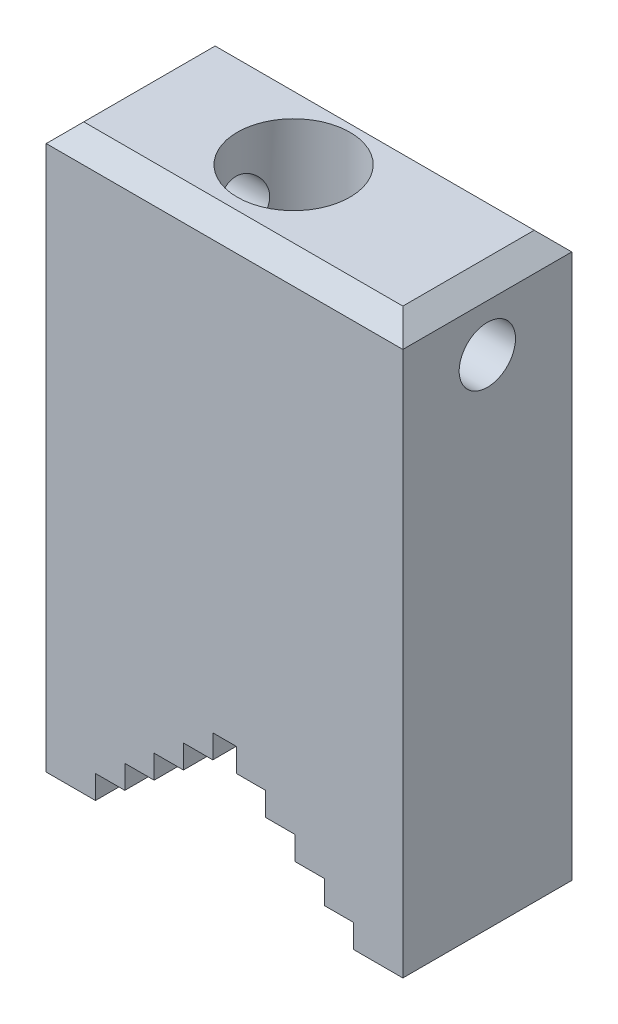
SolidWorks part; units mm, degrees
ref_plane "Front Plane" through (0, 0, 0) normal (0, 0, 1) x (1, 0, 0)
ref_plane "Top Plane" through (0, 0, 0) normal (0, 1, 0) x (1, 0, 0)
ref_plane "Right Plane" through (0, 0, 0) normal (1, 0, 0) x (0, 0, -1)
sketch "Sketch1" plane through (0, 0, 0) normal (0, 0, 1) x (1, 0, 0)
  line L0 (0, 0) -> (0, 23.3729) construction
  line L1 (-19, 0) -> (-13.75, 0)
  line L2 (-19, 0) -> (-19, 60)
  line L3 (-19, 60) -> (19, 60)
  line L4 (19, 0) -> (19, 60)
  line L5 (19, 0) -> (13.75, 0)
  line L6 (-13.75, 0) -> (-13.75, 2.5)
  line L7 (13.75, 0) -> (13.75, 2.5)
  line L8 (-13.75, 2.5) -> (-10.625, 2.5)
  line L9 (13.75, 2.5) -> (10.625, 2.5)
  line L10 (-10.625, 2.5) -> (-10.625, 5)
  line L11 (10.625, 2.5) -> (10.625, 5)
  line L12 (-10.625, 5) -> (-7.5, 5)
  line L13 (10.625, 5) -> (7.5, 5)
  line L14 (-7.5, 5) -> (-7.5, 7.5)
  line L15 (7.5, 5) -> (7.5, 7.5)
  line L16 (-7.5, 7.5) -> (-4.375, 7.5)
  line L17 (7.5, 7.5) -> (4.375, 7.5)
  line L18 (-4.375, 7.5) -> (-4.375, 10)
  line L19 (4.375, 7.5) -> (4.375, 10)
  line L20 (-4.375, 10) -> (-1.25, 10)
  line L21 (4.375, 10) -> (1.25, 10)
  line L22 (-1.25, 10) -> (-1.25, 12.5)
  line L23 (1.25, 10) -> (1.25, 12.5)
  line L24 (-1.25, 12.5) -> (1.25, 12.5)
  dimension "D1" = 2.5
  dimension "D2" = 60
  dimension "D3" = 2.5
  dimension "D4" = 27.5
  dimension "D5" = 38
extrude "Extrude1" add sketch "Sketch1" along normal mid plane 18
chamfer "Chamfer1" distance 2 angle 45 4 edges at (0, 60, -9) (-19, 60, 0) (0, 60, 9) (19, 60, 0)
hole_wizard "Ø12.0 Hole" positions "3DSketch1" profile "Sketch3" hole size "Ø12.0" standard "Ansi Metric"
sketch3d "3DSketch1"
  line L0 (-19, 58, 9) -> (-19, 58, -9) construction
  line L1 (-19, 58, -9) -> (19, 58, -9) construction
  point P0 (-1.8663, 60, -0.225)
  dimension "D1" = 17.25
  dimension "D2" = 9
sketch "Sketch3" plane through (-1.8663, 60, -0.225) normal (1, 0, 0) x (0, 0, 1)
  line L0 (0, 0) -> (0, 23.4641)
  line L1 (0, 23.4641) -> (6, 20)
  line L2 (6, 20) -> (6, 0)
  line L5 (6, 0) -> (0, 0)
  line L10 (0, 23.4641) -> (-6, 20) construction
  line L11 (0, -6.35) -> (0, 107.95) construction
  dimension "Hole Dia." = 12
  dimension "Hole Depth" = 20
  dimension "Drill Angle" = 120
other "Hole1"
sketch "Sketch4" plane through (19, 0, 0) normal (1, 0, 0) x (0, 0, -1)
  line L0 (7, 60) -> (-7, 60) construction
  line L1 (-9, 0) -> (-9, 58) construction
  circle A0 centre (0, 53) radius 3
  point P2 (0, 60)
  point P7 (87.9843, 54.203)
  dimension "D1" = 6
  dimension "D2" = 7
  dimension "D3" = 9
